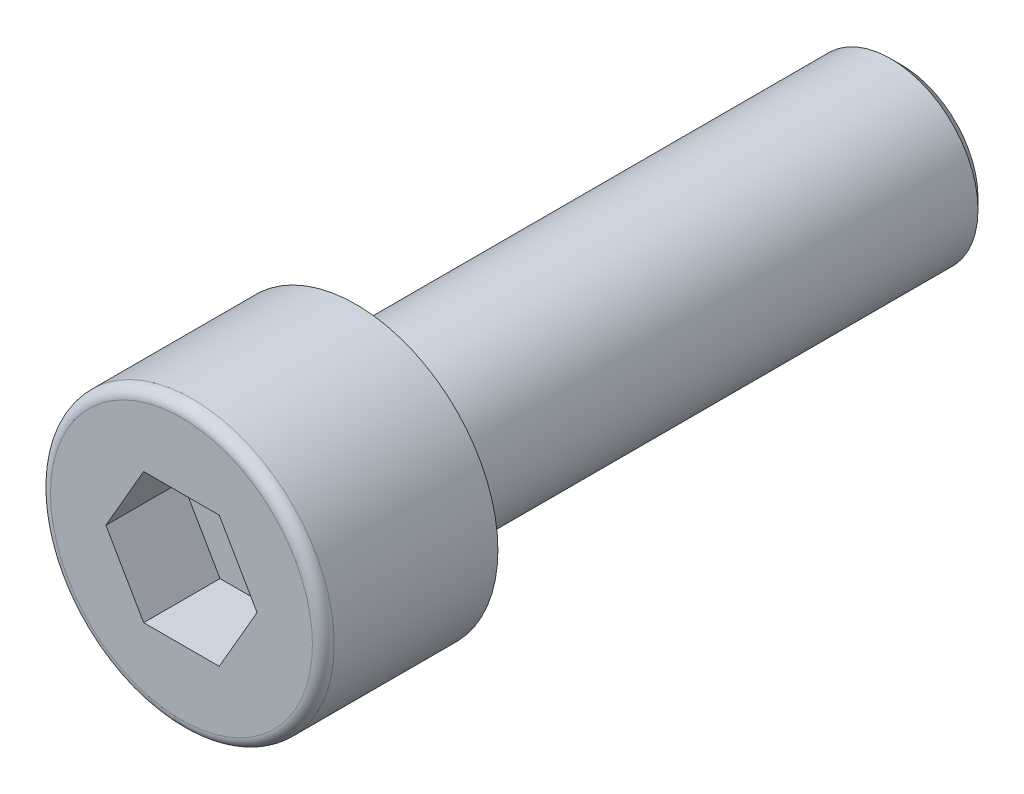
SolidWorks part; units mm, degrees
ref_plane "Plan1" through (0, 0, 0) normal (0, 0, 1) x (1, 0, 0)
ref_plane "Plan2" through (0, 0, 0) normal (0, 1, 0) x (1, 0, 0)
ref_plane "Plan3" through (0, 0, 0) normal (1, 0, 0) x (0, 0, -1)
sketch "Esquisse1" plane through (0, 0, 0) normal (0, 0, 1) x (1, 0, 0)
  circle A0 centre (0, 0) radius 4
  dimension "D1" = 8
extrude "Base-Extrusion" add sketch "Esquisse1" along normal blind 25
sketch "Esquisse2" plane through (0, 0, 25) normal (0, 0, 1) x (1, 0, 0)
  circle A0 centre (0, 0) radius 6.5
  dimension "D1" = 13
extrude "Boss.-Extru.1" add sketch "Esquisse2" along normal blind 8
sketch "Esquisse3" plane through (0, 0, 33) normal (0, 0, 1) x (1, 0, 0)
  line L0 (-1.7321, 3) -> (1.7321, 3)
  line L1 (3.4641, 0) -> (1.7321, 3)
  line L2 (0, 4.4254) -> (0, -0.8759) construction
  line L3 (-0.8874, 0) -> (5.2667, 0) construction
  line L4 (3.4641, 0) -> (1.7321, -3)
  line L5 (-1.7321, -3) -> (1.7321, -3)
  line L6 (-3.4641, 0) -> (-1.7321, -3)
  line L7 (-3.4641, 0) -> (-1.7321, 3)
  point P10 (0, -3)
  point P12 (0, 3)
  dimension "D1" = 3
  dimension "D2" = 3
extrude "Enlèv. mat.-Extru.1" cut sketch "Esquisse3" against normal blind 3.5
fillet "Congé2" radius 0.5
chamfer "Chanfrein1" distance 0.5 angle 45
